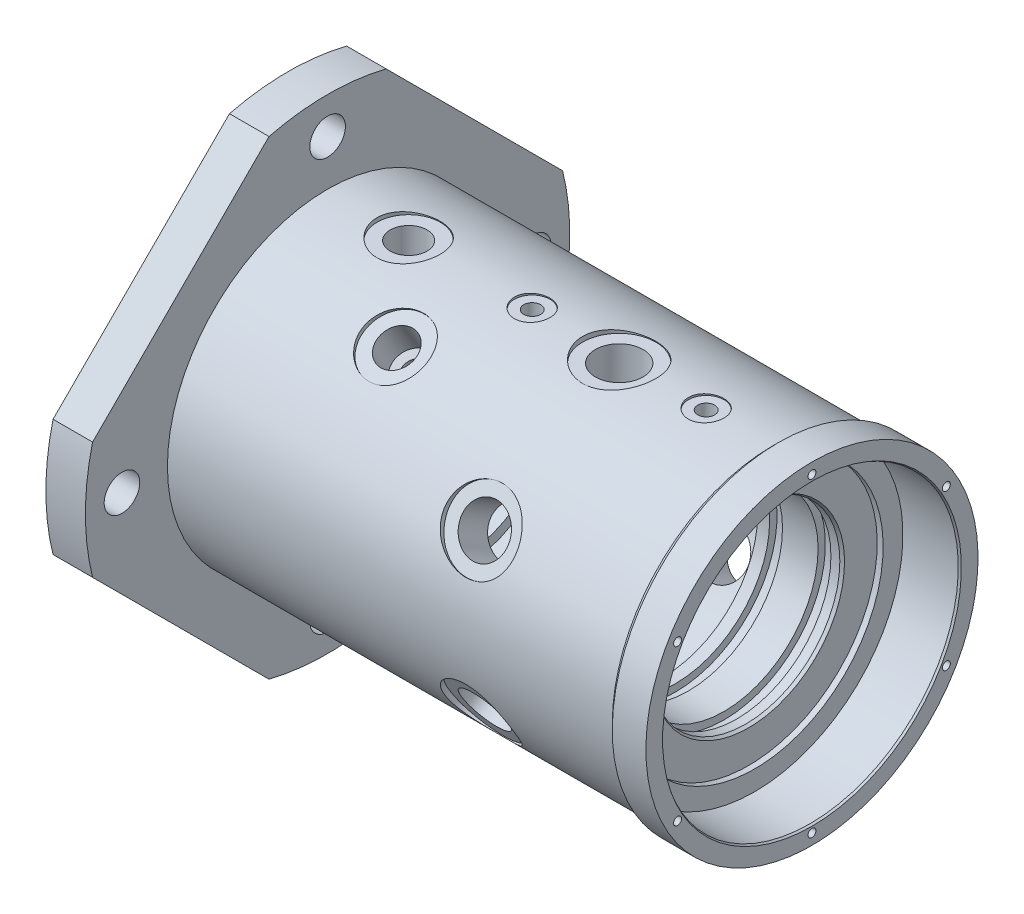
SolidWorks part; units mm, degrees
ref_plane "Face" through (0, 0, 0) normal (0, 0, 1) x (1, 0, 0)
ref_plane "Cote" through (0, 0, 0) normal (0, 1, 0) x (1, 0, 0)
ref_plane "Dessus" through (0, 0, 0) normal (1, 0, 0) x (0, 0, -1)
sketch "Esquisse1" plane through (0, 0, 0) normal (0, 0, 1) x (1, 0, 0)
  line L0 (0, 0) -> (-288.3314, 0) construction
  line L1 (-258.1724, 47.6) -> (-253.6724, 47.6)
  line L2 (-259.6724, 48.466) -> (-259.6724, 60)
  line L3 (-259.6724, 60) -> (-260.6724, 60)
  line L4 (-260.6724, 60) -> (-260.6724, 70)
  line L5 (-260.6724, 70) -> (-284.6724, 70)
  line L6 (-284.6724, 72) -> (-284.6724, 70)
  line L7 (-284.6724, 72) -> (-288.8224, 72)
  line L8 (-288.8224, 72) -> (-288.8224, 70)
  line L9 (-288.8224, 70) -> (-293.1724, 70)
  line L10 (-294.6724, 70.866) -> (-294.6724, 122.5)
  line L11 (-294.6724, 122.5) -> (-274.6724, 122.5)
  line L12 (-274.6724, 122.5) -> (-274.6724, 81)
  line L13 (-274.6724, 81) -> (-49.6724, 81)
  line L14 (-61.6724, 48.466) -> (-61.6724, 65)
  line L15 (-61.6724, 65) -> (-58.6724, 65)
  line L16 (-58.6724, 65) -> (-58.6724, 75)
  line L17 (-58.6724, 75) -> (-30.6724, 75)
  line L18 (-29.6724, 75.5774) -> (-29.6724, 84)
  line L19 (-29.6724, 84) -> (-46.6724, 84)
  line L20 (-46.6724, 84) -> (-49.6724, 81)
  line L21 (-259.6724, 48.466) -> (-258.1724, 47.6)
  line L22 (-293.1724, 70) -> (-294.6724, 70.866)
  line L23 (-61.6724, 48.466) -> (-63.1724, 47.6)
  line L24 (-29.6724, 75.5774) -> (-30.6724, 75)
  line L25 (-253.6724, 47.6) -> (-253.6724, 51.3)
  line L26 (-253.6724, 51.3) -> (-247.1724, 51.3)
  line L27 (-247.1724, 51.3) -> (-247.1724, 47.6)
  line L28 (-241.1724, 47.6) -> (-241.1724, 52.5)
  line L29 (-241.1724, 52.5) -> (-226.1724, 52.5)
  line L30 (-226.1724, 52.5) -> (-226.1724, 47.6)
  line L31 (-220.1724, 47.6) -> (-220.1724, 51.3)
  line L32 (-220.1724, 51.3) -> (-213.6724, 51.3)
  line L33 (-213.6724, 51.3) -> (-213.6724, 47.6)
  line L34 (-207.6724, 47.6) -> (-207.6724, 52.5)
  line L35 (-207.6724, 52.5) -> (-192.6724, 52.5)
  line L36 (-192.6724, 52.5) -> (-192.6724, 47.6)
  line L37 (-162.1724, 47.6) -> (-162.1724, 51.3)
  line L38 (-162.1724, 51.3) -> (-155.6724, 51.3)
  line L39 (-155.6724, 51.3) -> (-155.6724, 47.6)
  line L40 (-149.6724, 47.6) -> (-149.6724, 61.5)
  line L41 (-149.6724, 61.5) -> (-104.6724, 61.5)
  line L42 (-104.6724, 61.5) -> (-104.6724, 47.6)
  line L43 (-98.6724, 47.6) -> (-98.6724, 51.3)
  line L44 (-98.6724, 51.3) -> (-92.1724, 51.3)
  line L45 (-92.1724, 51.3) -> (-92.1724, 47.6)
  line L46 (-74.1724, 47.6) -> (-74.1724, 51.3)
  line L47 (-74.1724, 51.3) -> (-67.6724, 51.3)
  line L48 (-67.6724, 51.3) -> (-67.6724, 47.6)
  line L49 (-67.6724, 47.6) -> (-63.1724, 47.6)
  line L50 (-92.1724, 47.6) -> (-74.1724, 47.6)
  line L51 (-104.6724, 47.6) -> (-98.6724, 47.6)
  line L52 (-155.6724, 47.6) -> (-149.6724, 47.6)
  line L53 (-192.6724, 47.6) -> (-186.6724, 47.6)
  line L54 (-213.6724, 47.6) -> (-207.6724, 47.6)
  line L55 (-226.1724, 47.6) -> (-220.1724, 47.6)
  line L56 (-247.1724, 47.6) -> (-241.1724, 47.6)
  line L57 (-186.6724, 47.6) -> (-186.6724, 51.3)
  line L58 (-186.6724, 51.3) -> (-180.1724, 51.3)
  line L59 (-180.1724, 51.3) -> (-180.1724, 47.6)
  line L60 (-180.1724, 47.6) -> (-162.1724, 47.6)
  dimension "D1" = 95.2
  dimension "D2" = 30
  dimension "D3" = 1.5
  dimension "D4" = 30
  dimension "D5" = 1.5
  dimension "D6" = 30
  dimension "D7" = 1
  dimension "D8" = 30
  dimension "D9" = 1.5
  dimension "D10" = 245
  dimension "D11" = 162
  dimension "D12" = 168
  dimension "D13" = 17
  dimension "D14" = 45
  dimension "D15" = 130
  dimension "D16" = 150
  dimension "D17" = 29
  dimension "D18" = 32
  dimension "D19" = 120
  dimension "D20" = 140
  dimension "D21" = 144
  dimension "D22" = 4.15
  dimension "D23" = 10
  dimension "D24" = 34
  dimension "D25" = 35
  dimension "D26" = 245
  dimension "D27" = 265
  dimension "D28" = 102.6
  dimension "D29" = 6.5
  dimension "D30" = 105
  dimension "D31" = 15
  dimension "D32" = 123
  dimension "D33" = 45
  dimension "D34" = 47.5
  dimension "D35" = 68.5
  dimension "D36" = 81
  dimension "D37" = 102
  dimension "D38" = 114.5
  dimension "D39" = 44.5
  dimension "D40" = 69
  dimension "D41" = 120
  dimension "D42" = 132.5
revolve "profil" add sketch "Esquisse1" angle 360 about L0
sketch "axes" plane through (-29.6724, 0, 0) normal (1, 0, 0) x (0, 0, -1)
  line L0 (0, 138.8653) -> (0, -133.8499) construction
  line L1 (-139.8057, 0) -> (141.0596, 0) construction
  line L2 (117.7399, 67.9772) -> (-117.7399, -67.9772) construction
  line L3 (-116.2736, 67.1306) -> (116.2736, -67.1306) construction
  line L4 (0, 0) -> (98.1063, 98.1063) construction
  line L5 (0, 0) -> (-68.0928, 117.9402) construction
  line L6 (0, 0) -> (-92.9394, -92.9394) construction
  line L7 (-94.0488, 94.0488) -> (94.0488, -94.0488) construction
  circle A0 centre (0, 0) radius 104 construction
  circle A1 centre (0, 0) radius 78.5 construction
  dimension "D3" = 208
  dimension "D4" = 157
  dimension "D1" = 30
  dimension "D2" = 30
  dimension "D5" = 45
  dimension "D6" = 30
  dimension "D7" = 45
  dimension "D8" = 45
hole_wizard "1er  Ø 18" positions "Esquisse4" profile "Esquisse3" hole size "Ø8.0" standard "ISO"
sketch "Esquisse4" plane through (-274.6724, 0, 0) normal (1, 0, 0) x (0, 0, -1)
  line L0 (0, 138.8653) -> (0, -133.8499) construction
  circle A0 centre (0, 0) radius 104 construction
  point P0 (0, 104)
sketch "Esquisse3" plane through (-274.6724, 104, 0) normal (0, 1, 0) x (0, 0, -1)
  line L0 (0, 0) -> (0, 20)
  line L1 (0, 20) -> (9, 20)
  line L2 (9, 20) -> (9, 0)
  line L5 (9, 0) -> (0, 0)
  line L11 (0, -6.35) -> (0, 107.95) construction
  dimension "Diamètre du perçage jusqu'au prochain" = 18
  dimension "Profondeur du perçage jusqu'au prochain" = 20
pattern_circular "4 x Ø 18" count 4 over 360 about axis through (0, 0, 0) along (1, 0, 0) of "1er  Ø 18"
hole_wizard "1er M5" positions "Esquisse6" profile "Esquisse5" hole size "Ø8.0" standard "ISO"
sketch "Esquisse6" plane through (-29.6724, 0, 0) normal (1, 0, 0) x (0, 0, -1)
  line L0 (0, 138.8653) -> (0, -133.8499) construction
  circle A0 centre (0, 0) radius 78.5 construction
  point P0 (0, 78.5)
sketch "Esquisse5" plane through (-29.6724, 78.5, 0) normal (0, 1, 0) x (0, 0, -1)
  line L0 (0, 0) -> (0, 14.1599)
  line L1 (0, 14.1599) -> (2.009, 13)
  line L2 (2.009, 13) -> (2.009, 0)
  line L5 (2.009, 0) -> (0, 0)
  line L10 (0, 14.1599) -> (-2.009, 13) construction
  line L11 (0, -6.35) -> (0, 107.95) construction
  dimension "Diamètre du perçage" = 4.018
  dimension "Profondeur du perçage" = 13
  dimension "Angle de pointe" = 120
pattern_circular "6 x M5" count 6 over 360 about axis through (0, 0, 0) along (1, 0, 0) of "1er M5"
sketch "Esquisse7" plane through (-274.6724, 0, 0) normal (1, 0, 0) x (0, 0, -1)
  line L0 (7.349, 141.1434) -> (132.8503, 15.6421)
  line L1 (132.8503, 15.6421) -> (164.55, 47.3418)
  line L2 (164.55, 47.3418) -> (39.0487, 172.8431)
  line L3 (39.0487, 172.8431) -> (7.349, 141.1434)
  line L4 (0, 0) -> (98.1063, 98.1063) construction
  dimension "D1" = 105
extrude "1er plat" cut sketch "Esquisse7" against normal through all
pattern_circular "4 plats" count 4 over 360 about axis through (0, 0, 0) along (1, 0, 0) of "1er plat"
ref_plane "Plan1 D1" through (-83.1724, 0, 0) normal (1, 0, 0) x (0, 0, -1)
sketch "Esquisse8" plane through (-83.1724, 0, 0) normal (1, 0, 0) x (0, 0, -1)
  line L0 (0, 81) -> (-9, 81)
  line L1 (0, 138.8653) -> (0, -133.8499) construction
  line L2 (-9, 81) -> (-9, 80)
  line L3 (-4.283, 80) -> (-9, 80)
  line L4 (-4.283, 80) -> (-4.283, 70)
  line L5 (-4.283, 70) -> (-3, 69.2593)
  line L6 (-3, 69.2593) -> (-3, 39.7104)
  line L7 (-3, 39.7104) -> (0, 39.7104)
  line L8 (0, 92.1545) -> (0, 27.4883) construction
  line L9 (-139.8057, 0) -> (141.0596, 0) construction
  line L10 (0, 81) -> (0, 39.7104)
  dimension "D1" = 6
  dimension "D2" = 120
  dimension "D3" = 8.566
  dimension "D4" = 18
  dimension "D5" = 81
  dimension "D6" = 1
  dimension "D7" = 10
revolve "D1" cut sketch "Esquisse8" angle 360 about L8
pattern_linear "D2" count 2 spacing 88 along (-1, 0, 0) of "D1"
ref_plane "Plan2 cir 1A" through (-127.1724, 0, 0) normal (1, 0, 0) x (0, 0, -1)
sketch "Esquisse9" plane through (-127.1724, 0, 0) normal (1, 0, 0) x (0, 0, -1)
  line L0 (0, 0) -> (0, 88.8257) construction
  line L3 (0, 138.8653) -> (0, -133.8499) construction
  line L4 (0, 81) -> (-18.5, 81)
  line L5 (-18.5, 81) -> (-18.5, 78.5)
  line L6 (-18.5, 78.5) -> (-12.0585, 78.5)
  line L7 (-12.0585, 78.5) -> (-12.0585, 39.005)
  line L8 (-12.0585, 39.005) -> (0, 39.005)
  line L9 (-139.8057, 0) -> (141.0596, 0) construction
  line L10 (0, 81) -> (0, 39.005)
  dimension "D1" = 24.117
  dimension "D2" = 37
  dimension "D3" = 2.5
  dimension "D4" = 81
revolve "cir 1A" cut sketch "Esquisse9" angle 360 about L0
ref_plane "Plan3 cir 2" through (-200.1724, 0, 0) normal (1, 0, 0) x (0, 0, -1)
sketch "Esquisse10" plane through (-200.1724, 0, 0) normal (1, 0, 0) x (0, 0, -1)
  line L0 (-40.5, 70.1481) -> (-54.3564, 62.1481)
  line L2 (0, 0) -> (-68.0928, 117.9402) construction
  line L3 (-54.3564, 62.1481) -> (-53.3564, 60.416)
  line L4 (-53.3564, 60.416) -> (-47.5675, 63.7583)
  line L5 (-47.5675, 63.7583) -> (-39.5675, 49.9019)
  line L6 (-39.5675, 49.9019) -> (-35.7391, 49.9019)
  line L7 (-35.7391, 49.9019) -> (-24.9308, 31.1814)
  line L8 (-24.9308, 31.1814) -> (-19.7346, 34.1814)
  line L10 (-47.7024, 82.6229) -> (-13.7459, 23.8086) construction
  line L11 (-40.5, 70.1481) -> (-19.7346, 34.1814)
  dimension "D1" = 12
  dimension "D2" = 120
  dimension "D3" = 32
  dimension "D4" = 2
  dimension "D5" = 16
  dimension "D6" = 81
  dimension "D7" = 18.631
revolve "cir 2" cut sketch "Esquisse10" angle 360 about L10
ref_plane "Plan4 cir 3" through (-233.6724, 0, 0) normal (1, 0, 0) x (0, 0, -1)
sketch "Esquisse11" plane through (-233.6724, 0, 0) normal (1, 0, 0) x (0, 0, -1)
  line L0 (0, 81) -> (-16, 81)
  line L1 (0, 138.8653) -> (0, -133.8499) construction
  line L2 (-16, 81) -> (-16, 79)
  line L3 (-16, 79) -> (-9.3155, 79)
  line L4 (-9.3155, 79) -> (-9.3155, 63)
  line L5 (-9.3155, 63) -> (-6, 61.0858)
  line L6 (-6, 61.0858) -> (-6, 35.5502)
  line L7 (-6, 35.5502) -> (0, 35.5502)
  line L8 (0, 90.6657) -> (0, 29.2204) construction
  line L9 (-139.8057, 0) -> (141.0596, 0) construction
  line L10 (0, 81) -> (0, 35.5502)
  dimension "D1" = 12
  dimension "D2" = 120
  dimension "D3" = 18.631
  dimension "D4" = 32
  dimension "D5" = 2
  dimension "D6" = 16
  dimension "D7" = 81
revolve "cir 3" cut sketch "Esquisse11" angle 360 about L8
pattern_circular "6 x Ø 3/4\"G" count 6 over 360 about axis through (0, 0, 0) along (1, 0, 0) of "cir 1A"
sketch "Esquisse12" [suppressed] plane through (-29.6724, 0, 0) normal (1, 0, 0) x (0, 0, -1)
  line L1 (0, 0) -> (-208.1648, 0)
  line L2 (0, 0) -> (0, 240.9331)
  line L3 (0, 240.9331) -> (-208.1648, 240.9331)
  line L4 (-208.1648, 0) -> (-208.1648, 240.9331)
extrude "Enlèv. mat.-Extru.1" [suppressed] cut sketch "Esquisse12" against normal through all
